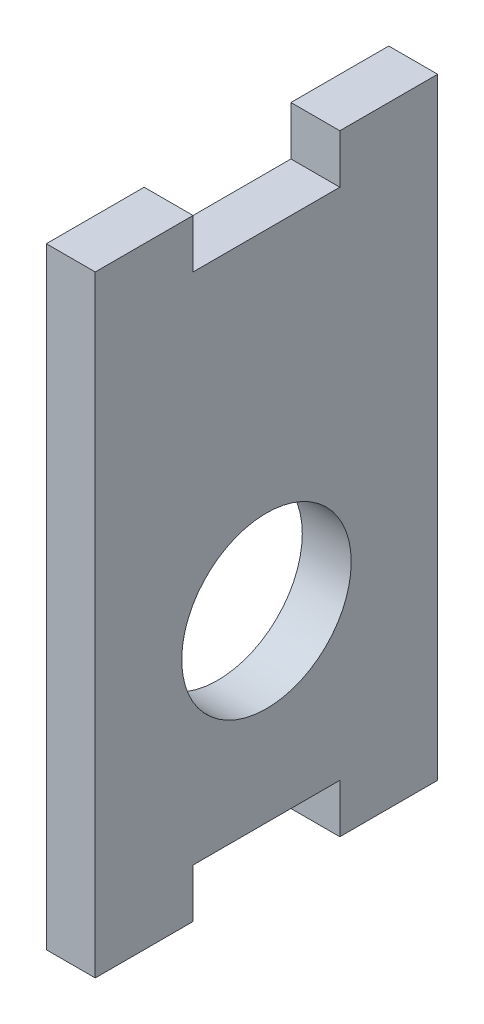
SolidWorks part; units mm, degrees
ref_plane "Front" through (0, 0, 0) normal (0, 0, 1) x (1, 0, 0)
ref_plane "Top" through (0, 0, 0) normal (0, 1, 0) x (1, 0, 0)
ref_plane "Right" through (0, 0, 0) normal (1, 0, 0) x (0, 0, -1)
sketch "Sketch1" plane through (0, 0, 0) normal (1, 0, 0) x (0, 0, -1)
  line L0 (-9.525, 0) -> (-9.525, -6.35)
  line L1 (-22.225, 73.025) -> (-9.525, 73.025)
  line L2 (-22.225, 73.025) -> (-22.225, -6.35)
  line L3 (-9.525, 0) -> (9.525, 0)
  line L4 (0, 0) -> (0, 66.675) construction
  line L5 (-9.525, -6.35) -> (-22.225, -6.35)
  line L6 (9.525, 73.025) -> (9.525, 66.675)
  line L7 (9.525, -6.35) -> (22.225, -6.35)
  line L8 (22.225, 73.025) -> (22.225, -6.35)
  line L9 (22.225, 73.025) -> (9.525, 73.025)
  line L10 (-9.525, 73.025) -> (-9.525, 66.675)
  line L11 (9.525, 0) -> (9.525, -6.35)
  line L12 (-9.525, 66.675) -> (9.525, 66.675)
  circle A0 centre (0, 23.8125) radius 11
  dimension "D4" = 22
  dimension "D1" = 19.05
  dimension "D2" = 6.35
  dimension "D3" = 66.675
  dimension "D5" = 23.8125
  dimension "D6" = 12.7
extrude "Extrude1" add sketch "Sketch1" along normal blind 6.35
